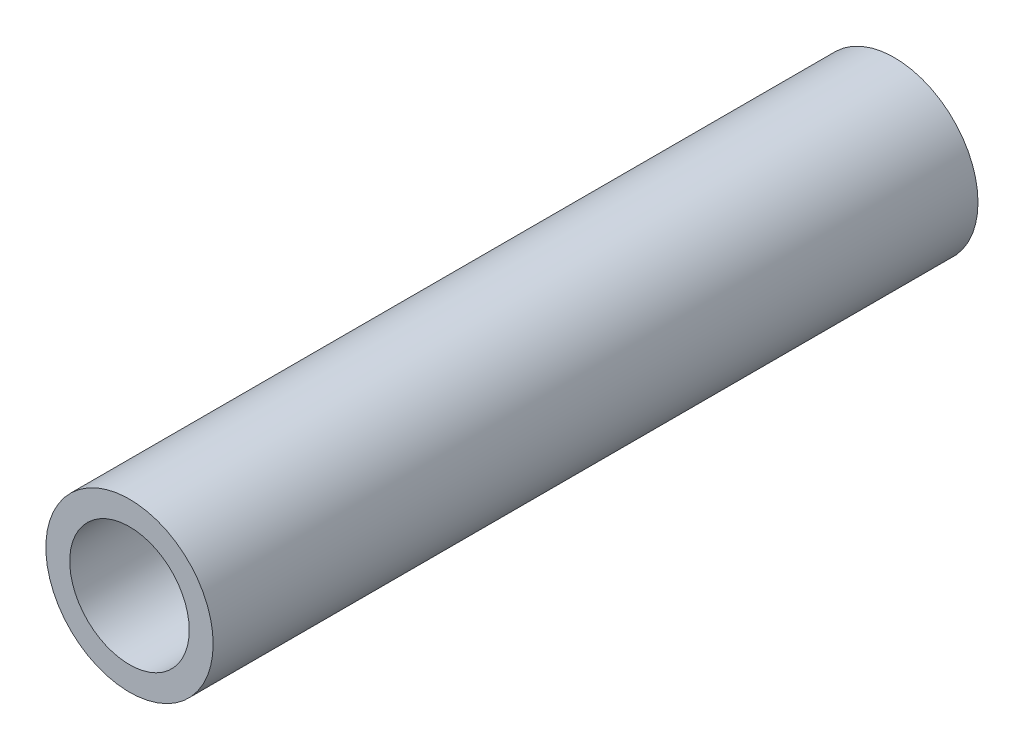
SolidWorks part; units mm, degrees
ref_plane "Front Plane" through (0, 0, 0) normal (0, 0, 1) x (1, 0, 0)
ref_plane "Top Plane" through (0, 0, 0) normal (0, 1, 0) x (1, 0, 0)
ref_plane "Right Plane" through (0, 0, 0) normal (1, 0, 0) x (0, 0, -1)
sketch "Sketch1" plane through (0, 0, 0) normal (0, 0, 1) x (1, 0, 0)
  circle A0 centre (0, 0) radius 11.1125
extrude "Extrude1" add sketch "Sketch1" along normal blind 101.6
sketch "Sketch2" plane through (0, 0, 101.6) normal (0, 0, 1) x (1, 0, 0)
  circle A0 centre (0, 0) radius 7.9375
extrude "Extrude2" cut sketch "Sketch2" against normal through all
